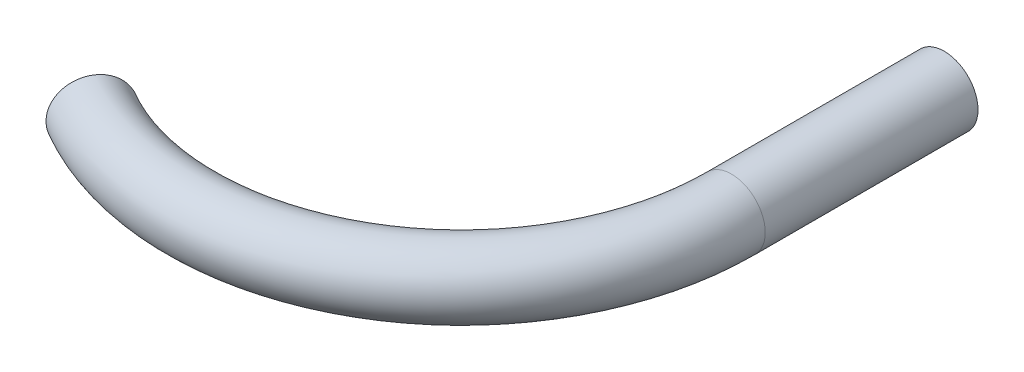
SolidWorks part; units mm, degrees
ref_plane "Front Plane" through (0, 0, 0) normal (0, 0, 1) x (1, 0, 0)
ref_plane "Top Plane" through (0, 0, 0) normal (0, 1, 0) x (1, 0, 0)
ref_plane "Right Plane" through (0, 0, 0) normal (1, 0, 0) x (0, 0, -1)
ref_axis "Axis1" through (0, 67.1486, 0) along (0, -1, 0)
sketch "Sketch1" plane through (0, 0, 0) normal (0, 0, 1) x (1, 0, 0)
  line L0 (55, 0) -> (-55, 0) construction
  line L1 (0, -55) -> (0, 55) construction
  circle A0 centre (12.7, 0) radius 1.5875
  circle A1 centre (12.7, 0) radius 0.7937
  dimension "D1" = 1.5875
  dimension "D2" = 3.175
  dimension "D3" = 12.7
revolve "Revolve1" add sketch "Sketch1" angle 120 about axis through (0, 67.1486, 0) along (0, -1, 0)
sketch "Sketch2" plane through (0, 0, 0) normal (0, 0, -1) x (-1, 0, 0)
  line L0 (55, 0) -> (-55, 0) construction
  circle A0 centre (-12.7, 0) radius 1.5875
  circle A1 centre (-12.7, 0) radius 0.7937
  circle A2 centre (-12.7, 0) radius 0.7937 construction
  circle A5 centre (-12.7, 0) radius 1.5875 construction
extrude "Boss-Extrude1" add sketch "Sketch2" along normal blind 10
